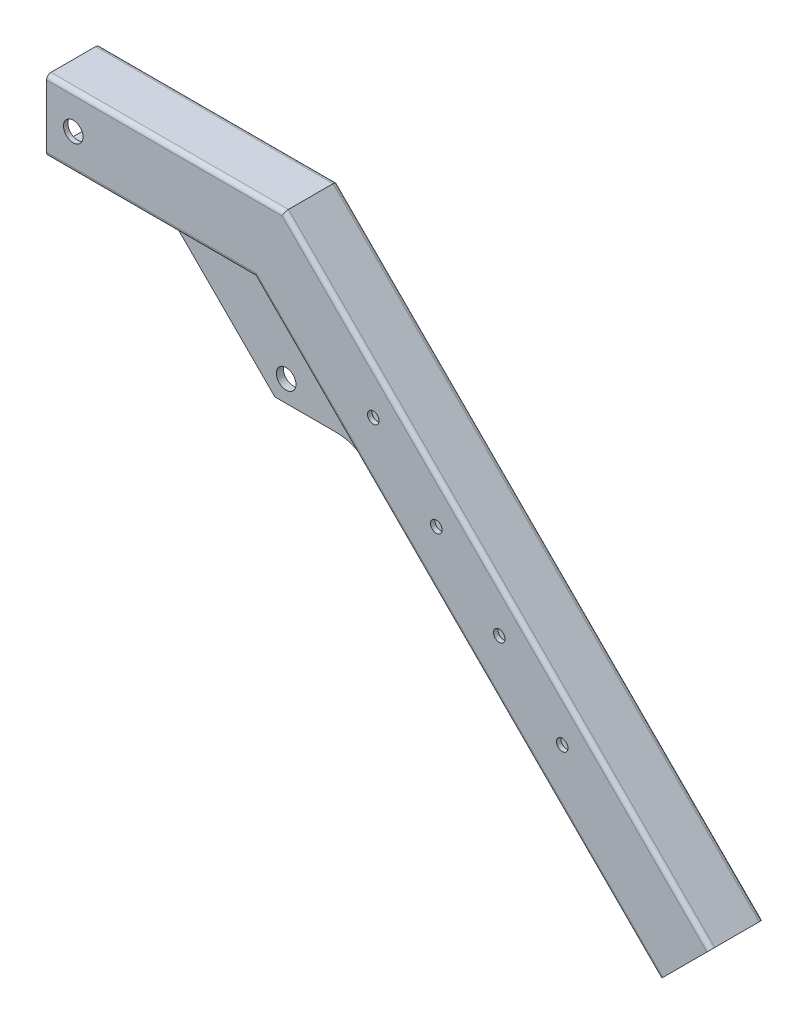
SolidWorks part; units mm, degrees
ref_plane "Plan de face" through (0, 0, 0) normal (0, 0, 1) x (1, 0, 0)
ref_plane "Plan de dessus" through (0, 0, 0) normal (0, 1, 0) x (1, 0, 0)
ref_plane "Plan de droite" through (0, 0, 0) normal (1, 0, 0) x (0, 0, -1)
sketch "Esquisse1" plane through (0, 0, 0) normal (0, 0, 1) x (1, 0, 0)
  line L0 (-30, 0) -> (220, 0)
  line L1 (220, 0) -> (686.6905, -466.6905)
  dimension "D1" = 250
  dimension "D2" = 30
  dimension "D3" = 660
  dimension "D4" = 135
extrude "Extru.-Mince2" add sketch "Esquisse1" along normal mid plane 60 thin
fillet "Congé1" radius 5 8 edges at (475.7716, -199.2031, 30) (103.2843, 40, 30) (86.7157, -40, 30) (430.9188, -267.4874, 30) (86.7157, -40, -30) (103.2843, 40, -30) (475.7716, -199.2031, -30) (430.9188, -267.4874, -30)
shell "Coque1" thickness 5
ref_plane "Plan1" through (0, 0, 26) normal (0, 0, 1) x (1, 0, 0)
sketch "Esquisse2" plane through (0, 0, 26) normal (0, 0, 1) x (1, 0, 0)
  line L0 (113.4315, -40) -> (222.3259, -148.8944)
  line L1 (203.4315, -40) -> (-30, -40) construction
  line L2 (222.3259, -148.8944) -> (312.3259, -148.8944)
  line L3 (658.4062, -494.9747) -> (203.4315, -40) construction
  line L4 (113.4315, -40) -> (203.4315, -40)
  line L5 (203.4315, -40) -> (312.3259, -148.8944)
  dimension "D1" = 90
  dimension "D2" = 154
extrude "Extrusion1" add sketch "Esquisse2" against normal blind 8
mirror "Symétrie1" about plane through (0, 0, 0) normal (0, 0, 1) of "Extrusion1"
sketch "Esquisse3" plane through (0, 0, 0) normal (0, 0, 1) x (1, 0, 0)
  line L0 (302.7894, -75.7183) -> (709.7433, -482.6722) construction
  line L1 (658.4062, -494.9747) -> (312.3259, -148.8944) construction
  circle A0 centre (0, 0) radius 11
  circle A1 centre (235, -125) radius 11
  circle A2 centre (336.8214, -109.7504) radius 6.5
  circle A3 centre (407.5321, -180.461) radius 6.5
  circle A4 centre (478.2428, -251.1717) radius 6.5
  circle A5 centre (548.9535, -321.8824) radius 6.5
  dimension "D1" = 22
  dimension "D4" = 13
  dimension "D2" = 125
  dimension "D3" = 235
  dimension "D5" = 100
  dimension "D6" = 100
  dimension "D7" = 100
  dimension "D8" = 45
extrude "Enlèv. mat.-Extru.1" cut sketch "Esquisse3" against normal through all and the other way through all
sketch "Esquisse4" plane through (85.2513, 85.2513, 0) normal (0.7071, 0.7071, 0) x (0, 0, -1)
  line L0 (0, -815.5635) -> (0, -793.661) construction
  line L1 (-25, -815.5635) -> (25, -815.5635) construction
  line L3 (-22.5, -815.5635) -> (22.5, -815.5635)
  line L4 (-22.5, -815.5635) -> (-22.5, -795.5635)
  line L5 (-22.5, -795.5635) -> (22.5, -795.5635)
  line L6 (22.5, -815.5635) -> (22.5, -795.5635)
  dimension "D1" = 45
  dimension "D2" = 20
extrude "Extrusion2" add sketch "Esquisse4" along normal blind 10
ref_plane "A_S/B" through (0, 0, 0) normal (-0.8705, -0.4921, 0) x (0, 0, 1)
ref_plane "F_TV/B" through (235, -125, 0) normal (0.8514, 0.5246, 0) x (0, 0, -1)
fillet "Congé2" radius 50 4 edges at (312.3259, -148.8944, 21.5) (312.3259, -148.8944, 25.5) (312.3259, -148.8944, -25.5) (312.3259, -148.8944, -21.5)
